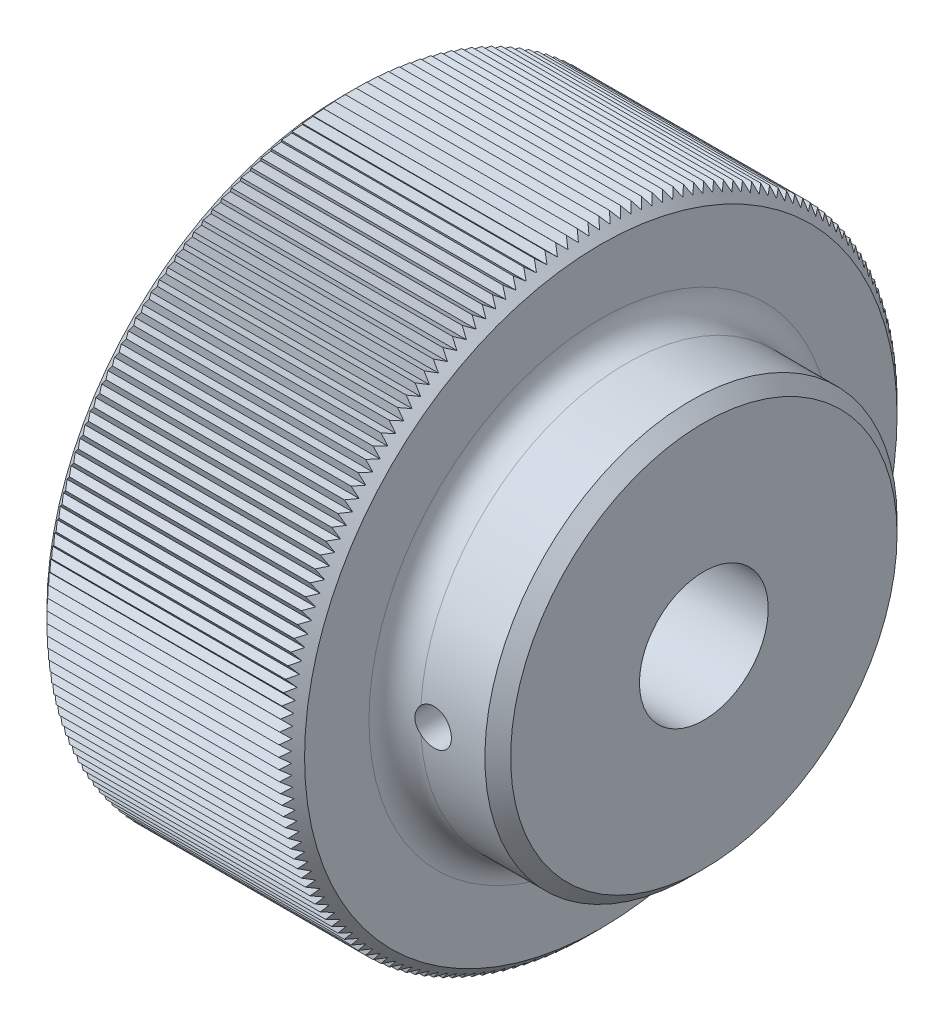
SolidWorks part; units mm, degrees
ref_plane "Front Plane" through (0, 0, 0) normal (0, 0, 1) x (1, 0, 0)
ref_plane "Top Plane" through (0, 0, 0) normal (0, 1, 0) x (1, 0, 0)
ref_plane "Right Plane" through (0, 0, 0) normal (1, 0, 0) x (0, 0, -1)
sketch "Sketch1" plane through (0, 0, 0) normal (1, 0, 0) x (0, 0, -1)
  circle A0 centre (0, 0) radius 12
  dimension "D1" = 24
extrude "Extrude1" add sketch "Sketch1" against normal blind 10
chamfer "Chamfer1" distance 0.5 angle 45 2 edges at (-10, 0, -12) (0, 0, -12)
sketch "Sketch2" plane through (0, 0, 0) normal (1, 0, 0) x (0, 0, -1)
  line L0 (0, 0) -> (0, 50000) construction
  line L1 (0, 0) -> (-872.6203, 49992.3848) construction
  line L2 (0, 12) -> (-0.2051, 11.75)
  line L3 (-0.4188, 11.9927) -> (-0.2051, 11.75)
  circle A0 centre (0, 0) radius 12 construction
  arc A1 (-0.4188, 11.9927) -> (0, 12) centre (-0.2125, 12.1743) cw
  dimension "D1" = 1
  dimension "D2" = 0.25
extrude "Extrude2" cut sketch "Sketch2" against normal through all
pattern_circular "CirPattern1" count 180 over 360 about axis through (0, 0, 0) along (1, 0, 0) of "Extrude2"
sketch "Sketch3" plane through (0, 0, 0) normal (1, 0, 0) x (0, 0, -1)
  circle A0 centre (0, 0) radius 8
  dimension "D1" = 16
extrude "Extrude3" add sketch "Sketch3" along normal blind 4
fillet "Fillet1" radius 1 1 edges at (0, 0, -8)
sketch "Sketch4" plane through (-10, 0, 0) normal (-1, 0, 0) x (0, 0, 1)
  circle A0 centre (0, 0) radius 2.5
  dimension "D1" = 5
extrude "Extrude4" cut sketch "Sketch4" against normal through all
sketch "Sketch5" plane through (-10, 0, 0) normal (-1, 0, 0) x (0, 0, 1)
  circle A0 centre (0, 0) radius 9
  dimension "D1" = 18
extrude "Extrude5" cut sketch "Sketch5" against normal blind 6
chamfer "Chamfer2" distance 0.5 angle 45 3 edges at (-10, 0, 9) (4, 0, -8) (-4, 0, 2.5)
sketch "Sketch6" plane through (0, 0, 0) normal (0, 0, 1) x (1, 0, 0)
  line L0 (4, -7.5) -> (4, 7.5) construction
  circle A0 centre (1.5, 0) radius 0.7
  dimension "D1" = 1.4
  dimension "D2" = 2.5
extrude "Extrude6" cut sketch "Sketch6" along normal through all
